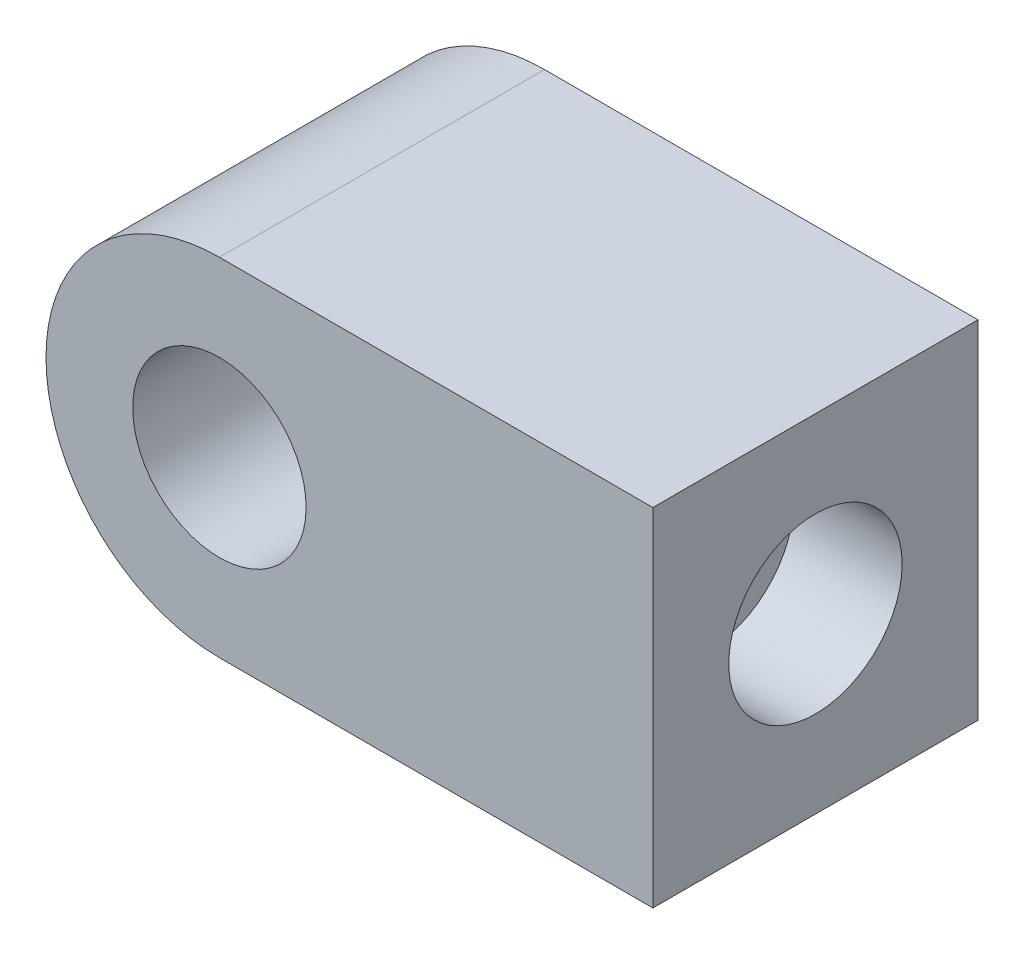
SolidWorks part; units mm, degrees
ref_plane "Ön Düzlem" through (0, 0, 0) normal (0, 0, 1) x (1, 0, 0)
ref_plane "Üst Düzlem" through (0, 0, 0) normal (0, 1, 0) x (1, 0, 0)
ref_plane "Sağ Düzlem" through (0, 0, 0) normal (1, 0, 0) x (0, 0, -1)
sketch "Çizim1" plane through (0, 0, 0) normal (0, 0, 1) x (1, 0, 0)
  line L0 (0, 8) -> (20, 8)
  line L1 (20, 8) -> (20, -8)
  line L2 (20, -8) -> (0, -8)
  arc A0 (0, 8) -> (0, -8) centre (0, 0) ccw
  circle A1 centre (0, 0) radius 4
  dimension "D1" = 16
  dimension "D3" = 8
  dimension "D2" = 20
extrude "Yükseklik-Ekstrüzyon1" add sketch "Çizim1" along normal blind 15
sketch "Çizim2" plane through (20, 0, 0) normal (1, 0, 0) x (0, 0, -1)
  line L0 (-15, -8) -> (-15, 8) construction
  line L1 (-15, 8) -> (0, 8) construction
  circle A0 centre (-7.5, 0) radius 4
  dimension "D2" = 8
  dimension "D3" = 8
  dimension "D1" = 7.5
extrude "Kes-Ekstrüzyon1" cut sketch "Çizim2" against normal blind 5
